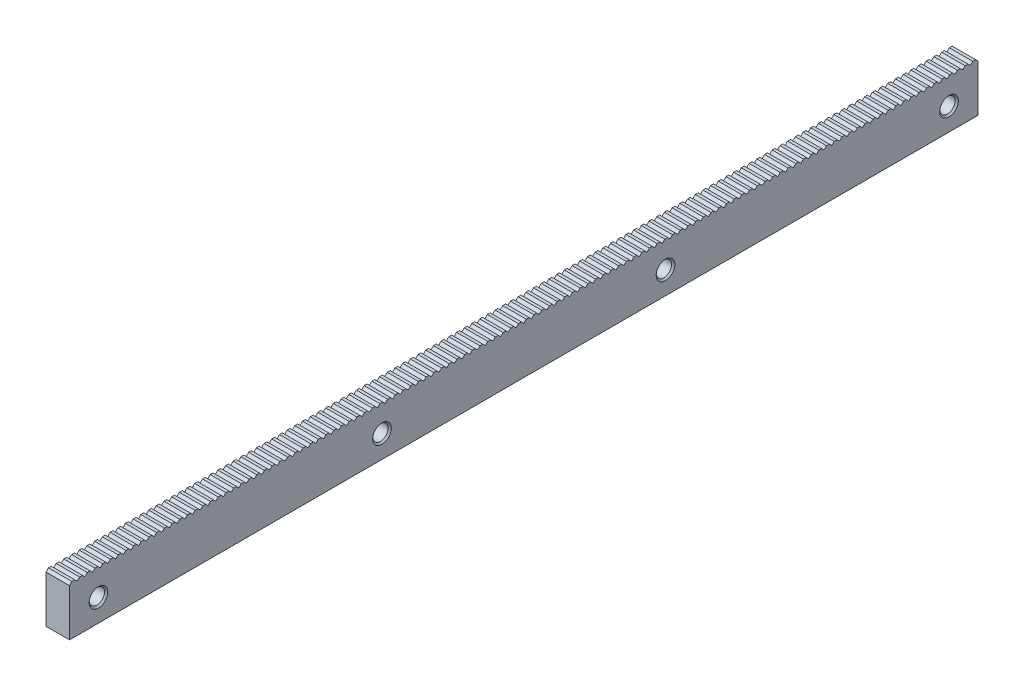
SolidWorks part; units mm, degrees
ref_plane "Front Plane" through (0, 0, 0) normal (0, 0, 1) x (1, 0, 0)
ref_plane "Top Plane" through (0, 0, 0) normal (0, 1, 0) x (1, 0, 0)
ref_plane "Right Plane" through (0, 0, 0) normal (1, 0, 0) x (0, 0, -1)
sketch "Sketch1" plane through (0, 0, 0) normal (1, 0, 0) x (0, 0, -1)
  line L1 (112.15, -6.1) -> (-112.15, -6.1)
  line L2 (112.15, -6.1) -> (112.15, 6.1)
  line L3 (112.15, 6.1) -> (-112.15, 6.1)
  line L4 (-112.15, -6.1) -> (-112.15, 6.1)
  line L5 (112.15, -6.1) -> (-112.15, 6.1) construction
  line L6 (112.15, 6.1) -> (-112.15, -6.1) construction
  point P0 (0, 0)
  dimension "D1" = 224.3
  dimension "D2" = 12.2
extrude "Boss-Extrude1" add sketch "Sketch1" along normal mid plane 5.8
sketch "Sketch2" plane through (0, 0, 0) normal (1, 0, 0) x (0, 0, -1)
  line L0 (-112.15, 5.5) -> (-112.75, 6.1)
  line L1 (-112.15, 6.1) -> (-112.15, -6.1) construction
  line L2 (-112.75, 6.1) -> (-111.55, 6.1)
  line L3 (112.15, 6.1) -> (-112.15, 6.1) construction
  line L4 (-111.55, 6.1) -> (-112.15, 5.5)
  line L5 (-112.15, -6.1) -> (112.15, -6.1) construction
  point P8 (-112.15, 5.5)
  dimension "D1" = 11.6
extrude "Cut-Extrude1" cut sketch "Sketch2" against normal mid plane 5.8
pattern_linear "LPattern1" count 119 spacing 1.901 along (0, -0.7071, -0.7071) of "Cut-Extrude1"
sketch "Sketch3" plane through (0, 0, 0) normal (1, 0, 0) x (0, 0, -1)
  line L0 (-112.15, -6.1) -> (112.15, -6.1) construction
  line L1 (-112.15, 5.5) -> (-112.15, -6.1) construction
  circle A0 centre (-105, -0.56) radius 1.9
  dimension "D3" = 3.8
  dimension "D1" = 5.54
  dimension "D2" = 7.15
extrude "Cut-Extrude2" cut sketch "Sketch3" against normal mid plane 5.8
chamfer "Chamfer1" distance 0.4 angle 45 2 edges at (-2.9, -0.56, 103.1) (2.9, -0.56, 103.1)
pattern_linear "LPattern2" count 4 spacing 70 along (0, 0, -1) of "Cut-Extrude2", "Chamfer1"
